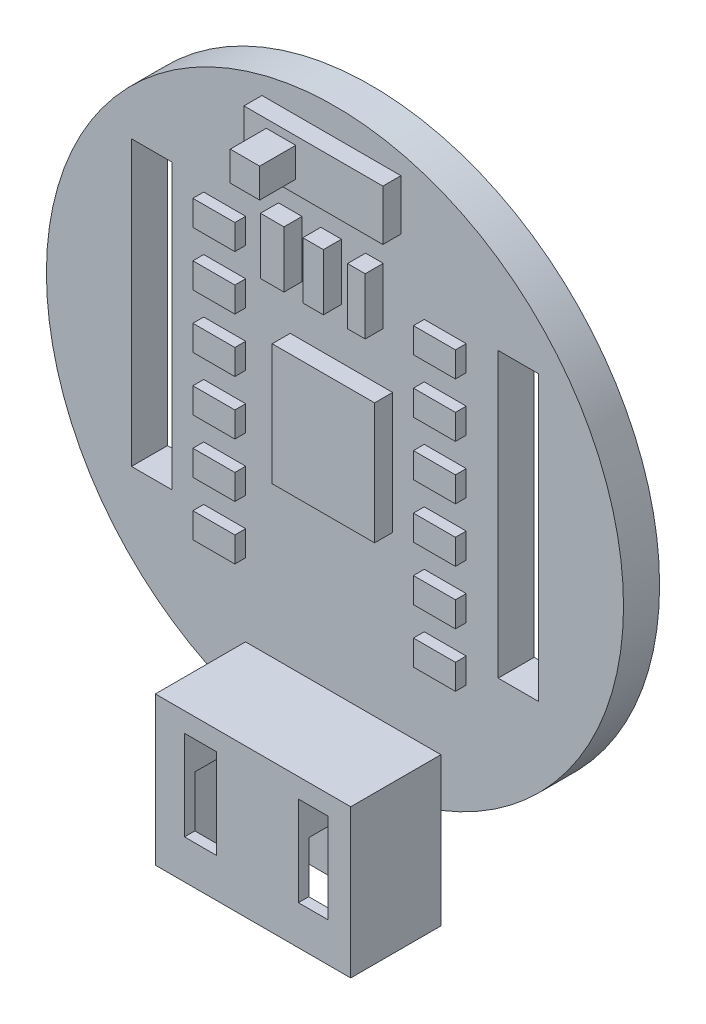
SolidWorks part; units mm, degrees
ref_plane "정면" through (0, 0, 0) normal (0, 0, 1) x (1, 0, 0)
ref_plane "윗면" through (0, 0, 0) normal (0, 1, 0) x (1, 0, 0)
ref_plane "우측면" through (0, 0, 0) normal (1, 0, 0) x (0, 0, -1)
sketch "스케치1" plane through (0, 0, 0) normal (0, 0, 1) x (1, 0, 0)
  circle A0 centre (-18.6577, 41.11) radius 1.6
extrude "보스-돌출1" add sketch "스케치1" along normal blind 0.2
sketch "스케치2" plane through (0, 0, 0.2) normal (0, 0, 1) x (1, 0, 0)
  line L0 (-18.6577, 41.11) -> (-18.6577, 43.5816) construction
  line L1 (-19.786, 41.9894) -> (-19.5625, 41.9894)
  line L2 (-19.786, 41.9894) -> (-19.786, 40.4158)
  line L3 (-19.786, 40.4158) -> (-19.5625, 40.4158)
  line L4 (-19.5625, 41.9894) -> (-19.5625, 40.4158)
  line L5 (-17.753, 41.9894) -> (-17.753, 40.4158)
  line L6 (-17.5295, 40.4158) -> (-17.753, 40.4158)
  line L7 (-17.5295, 41.9894) -> (-17.5295, 40.4158)
  line L8 (-17.5295, 41.9894) -> (-17.753, 41.9894)
extrude "컷-돌출1" cut sketch "스케치2" against normal blind 0.2
sketch "스케치3" plane through (0, 0, 0.2) normal (0, 0, 1) x (1, 0, 0)
  line L0 (-19.3856, 41.6335) -> (-19.3856, 41.4938)
  line L1 (-19.3856, 41.9335) -> (-19.1528, 41.9335)
  line L2 (-19.3856, 41.9335) -> (-19.3856, 41.7938)
  line L3 (-19.3856, 41.7938) -> (-19.1528, 41.7938)
  line L4 (-19.1528, 41.9335) -> (-19.1528, 41.7938)
  line L5 (-19.3856, 41.6335) -> (-19.1528, 41.6335)
  line L6 (-19.1528, 41.6335) -> (-19.1528, 41.4938)
  line L7 (-19.3856, 41.4938) -> (-19.1528, 41.4938)
  line L8 (-19.3856, 41.3335) -> (-19.3856, 41.1938)
  line L9 (-19.3856, 41.3335) -> (-19.1528, 41.3335)
  line L10 (-19.1528, 41.3335) -> (-19.1528, 41.1938)
  line L11 (-19.3856, 41.1938) -> (-19.1528, 41.1938)
  line L12 (-19.3856, 41.0335) -> (-19.3856, 40.8938)
  line L13 (-19.3856, 41.0335) -> (-19.1528, 41.0335)
  line L14 (-19.1528, 41.0335) -> (-19.1528, 40.8938)
  line L15 (-19.3856, 40.8938) -> (-19.1528, 40.8938)
  line L16 (-19.3856, 40.7335) -> (-19.3856, 40.5938)
  line L17 (-19.3856, 40.7335) -> (-19.1528, 40.7335)
  line L18 (-19.1528, 40.7335) -> (-19.1528, 40.5938)
  line L19 (-19.3856, 40.5938) -> (-19.1528, 40.5938)
  line L20 (-19.3856, 40.4335) -> (-19.3856, 40.2938)
  line L21 (-19.3856, 40.4335) -> (-19.1528, 40.4335)
  line L22 (-19.1528, 40.4335) -> (-19.1528, 40.2938)
  line L23 (-19.3856, 40.2938) -> (-19.1528, 40.2938)
  line L24 (-18.6577, 41.11) -> (-18.6577, 43.684) construction
  line L25 (-17.9299, 40.2938) -> (-18.1627, 40.2938)
  line L26 (-18.1627, 40.4335) -> (-18.1627, 40.2938)
  line L27 (-17.9299, 40.4335) -> (-18.1627, 40.4335)
  line L28 (-17.9299, 40.4335) -> (-17.9299, 40.2938)
  line L29 (-17.9299, 40.5938) -> (-18.1627, 40.5938)
  line L30 (-18.1627, 40.7335) -> (-18.1627, 40.5938)
  line L31 (-17.9299, 40.7335) -> (-18.1627, 40.7335)
  line L32 (-17.9299, 40.7335) -> (-17.9299, 40.5938)
  line L33 (-17.9299, 40.8938) -> (-18.1627, 40.8938)
  line L34 (-18.1627, 41.0335) -> (-18.1627, 40.8938)
  line L35 (-17.9299, 41.0335) -> (-18.1627, 41.0335)
  line L36 (-17.9299, 41.0335) -> (-17.9299, 40.8938)
  line L37 (-17.9299, 41.1938) -> (-18.1627, 41.1938)
  line L38 (-18.1627, 41.3335) -> (-18.1627, 41.1938)
  line L39 (-17.9299, 41.3335) -> (-18.1627, 41.3335)
  line L40 (-17.9299, 41.3335) -> (-17.9299, 41.1938)
  line L41 (-17.9299, 41.4938) -> (-18.1627, 41.4938)
  line L42 (-18.1627, 41.6335) -> (-18.1627, 41.4938)
  line L43 (-17.9299, 41.6335) -> (-18.1627, 41.6335)
  line L44 (-18.1627, 41.9335) -> (-18.1627, 41.7938)
  line L45 (-17.9299, 41.7938) -> (-18.1627, 41.7938)
  line L46 (-17.9299, 41.9335) -> (-17.9299, 41.7938)
  line L47 (-17.9299, 41.9335) -> (-18.1627, 41.9335)
  line L48 (-17.9299, 41.6335) -> (-17.9299, 41.4938)
  dimension "D1" = 6
extrude "보스-돌출2" add sketch "스케치3" along normal blind 0.06
sketch "스케치4" plane through (0, 0, 0.2) normal (0, 0, 1) x (1, 0, 0)
  line L1 (-18.9057, 41.4951) -> (-18.3379, 41.4951)
  line L2 (-18.9057, 41.4951) -> (-18.9057, 40.8228)
  line L3 (-18.9057, 40.8228) -> (-18.3379, 40.8228)
  line L4 (-18.3379, 41.4951) -> (-18.3379, 40.8228)
  line L5 (-18.971, 42.089) -> (-18.8405, 42.089)
  line L6 (-18.971, 42.089) -> (-18.971, 41.7757)
  line L7 (-18.971, 41.7757) -> (-18.8405, 41.7757)
  line L8 (-18.8405, 42.089) -> (-18.8405, 41.7757)
  line L9 (-18.736, 42.089) -> (-18.6218, 42.089)
  line L10 (-18.736, 42.089) -> (-18.736, 41.7757)
  line L11 (-18.736, 41.7757) -> (-18.6218, 41.7757)
  line L12 (-18.6218, 42.089) -> (-18.6218, 41.7757)
  line L13 (-18.488, 42.089) -> (-18.3901, 42.089)
  line L14 (-18.488, 42.089) -> (-18.488, 41.7757)
  line L15 (-18.488, 41.7757) -> (-18.3901, 41.7757)
  line L16 (-18.3901, 42.089) -> (-18.3901, 41.7757)
  line L17 (-19.0624, 42.5589) -> (-18.2922, 42.5589)
  line L18 (-19.0624, 42.5589) -> (-19.0624, 42.2783)
  line L19 (-19.0624, 42.2783) -> (-18.2922, 42.2783)
  line L20 (-18.2922, 42.5589) -> (-18.2922, 42.2783)
extrude "보스-돌출3" add sketch "스케치4" along normal blind 0.1
sketch "스케치5" plane through (0, 0, 0.2) normal (0, 0, 1) x (1, 0, 0)
  line L1 (-18.9384, 42.5132) -> (-18.7752, 42.5132)
  line L2 (-18.9384, 42.5132) -> (-18.9384, 42.3501)
  line L3 (-18.9384, 42.3501) -> (-18.7752, 42.3501)
  line L4 (-18.7752, 42.5132) -> (-18.7752, 42.3501)
extrude "보스-돌출4" add sketch "스케치5" along normal blind 0.3
sketch "스케치6" plane through (0, 0, 0.2) normal (0, 0, 1) x (1, 0, 0)
  line L1 (-19.1537, 39.8895) -> (-18.0703, 39.8895)
  line L2 (-19.1537, 39.8895) -> (-19.1537, 39.0672)
  line L3 (-19.1537, 39.0672) -> (-18.0703, 39.0672)
  line L4 (-18.0703, 39.8895) -> (-18.0703, 39.0672)
extrude "보스-돌출5" add sketch "스케치6" along normal blind 0.5
sketch "스케치7" plane through (0, 0, 0.7) normal (0, 0, 1) x (1, 0, 0)
  line L1 (-18.9921, 39.7815) -> (-18.8137, 39.7815)
  line L2 (-18.9921, 39.7815) -> (-18.9921, 39.2837)
  line L3 (-18.9921, 39.2837) -> (-18.8137, 39.2837)
  line L4 (-18.8137, 39.7815) -> (-18.8137, 39.2837)
  line L5 (-18.3605, 39.7815) -> (-18.1971, 39.7815)
  line L6 (-18.3605, 39.7815) -> (-18.3605, 39.2837)
  line L7 (-18.3605, 39.2837) -> (-18.1971, 39.2837)
  line L8 (-18.1971, 39.7815) -> (-18.1971, 39.2837)
extrude "컷-돌출2" cut sketch "스케치7" against normal blind 0.3
sketch "스케치8" plane through (0, 39.0672, 0) normal (0, -1, 0) x (1, 0, 0)
  line L1 (-19.0612, 0.6425) -> (-18.1332, 0.6425)
  line L2 (-19.0612, 0.6425) -> (-19.0612, 0.2693)
  line L3 (-19.0612, 0.2693) -> (-18.1332, 0.2693)
  line L4 (-18.1332, 0.6425) -> (-18.1332, 0.2693)
extrude "컷-돌출3" cut sketch "스케치8" against normal blind 0.5
